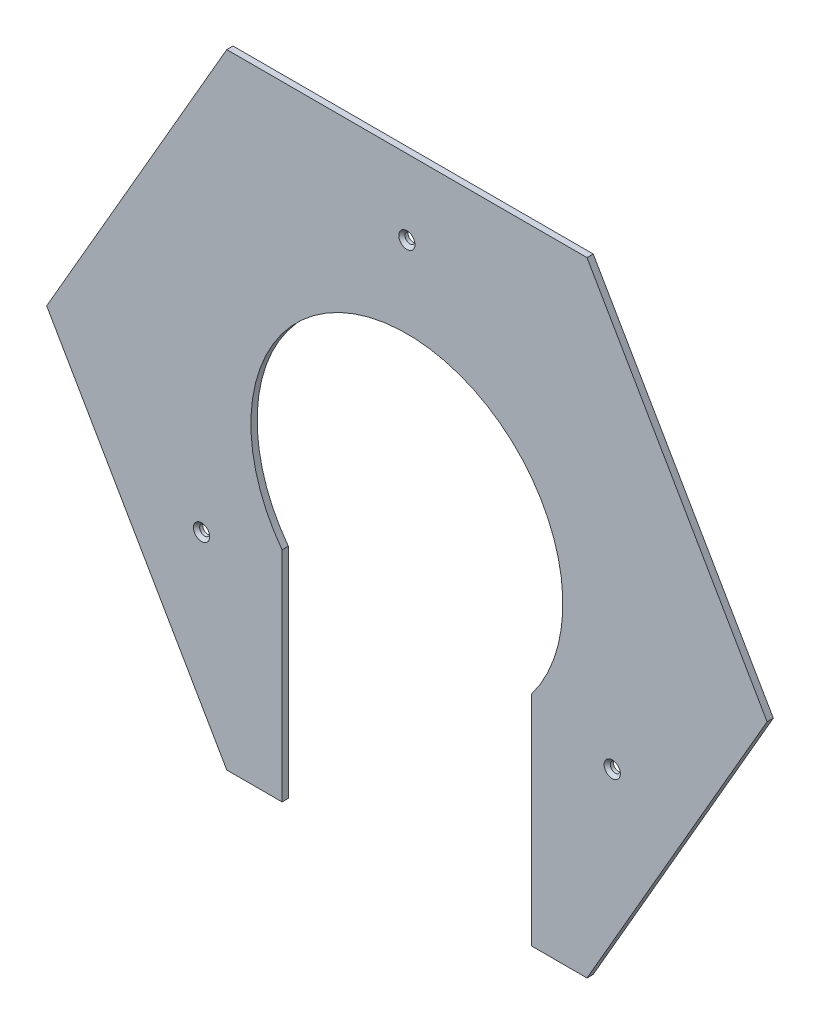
SolidWorks part; units mm, degrees
ref_plane "Front Plane" through (0, 0, 0) normal (0, 0, 1) x (1, 0, 0)
ref_plane "Top Plane" through (0, 0, 0) normal (0, 1, 0) x (1, 0, 0)
ref_plane "Right Plane" through (0, 0, 0) normal (1, 0, 0) x (0, 0, -1)
sketch "Sketch1" plane through (0, 0, 0) normal (0, 0, 1) x (1, 0, 0)
  line L0 (-40, -100) -> (-40, -30)
  line L1 (115.47, 0) -> (57.735, 100)
  line L2 (57.735, 100) -> (-57.735, 100)
  line L3 (-57.735, 100) -> (-115.47, 0)
  line L4 (-115.47, 0) -> (-57.735, -100)
  line L5 (-57.735, -100) -> (-40, -100)
  line L6 (57.735, -100) -> (115.47, 0)
  line L7 (0, 100) -> (0, 50) construction
  line L8 (40, -100) -> (40, -30)
  line L9 (40, -100) -> (57.735, -100)
  circle A0 centre (0, 0) radius 115.47 construction
  arc A1 (40, -30) -> (-40, -30) centre (0, 0) ccw
  circle A2 centre (0, 76) radius 1.6
  circle A3 centre (65.8179, -38) radius 1.6
  circle A4 centre (-65.8179, -38) radius 1.6
  dimension "D1" = 230.94
  dimension "D2" = 100
  dimension "D4" = 3.2
  dimension "D3" = 40
  dimension "D5" = 76
  dimension "D7" = 76
  dimension "D6" = 3
sheet metal parameters "Sheet-Metal1" thickness 2 parameters "D1"=0.7366
base flange "Base-Flange1" sketch "Sketch1" thickness 2 reverse thickness direction no parameters "D1"=0.7366
chamfer "Chamfer1" distance 1 angle 45 3 edges at (67.4179, -38, 0) (-64.2179, -38, 0) (1.6, 76, 0)
flat pattern "Flat-Pattern1"
sketch "Bend-Lines1" plane through (0, 0, 0) normal (0, 1, 0) x (-1, 0, 0)
